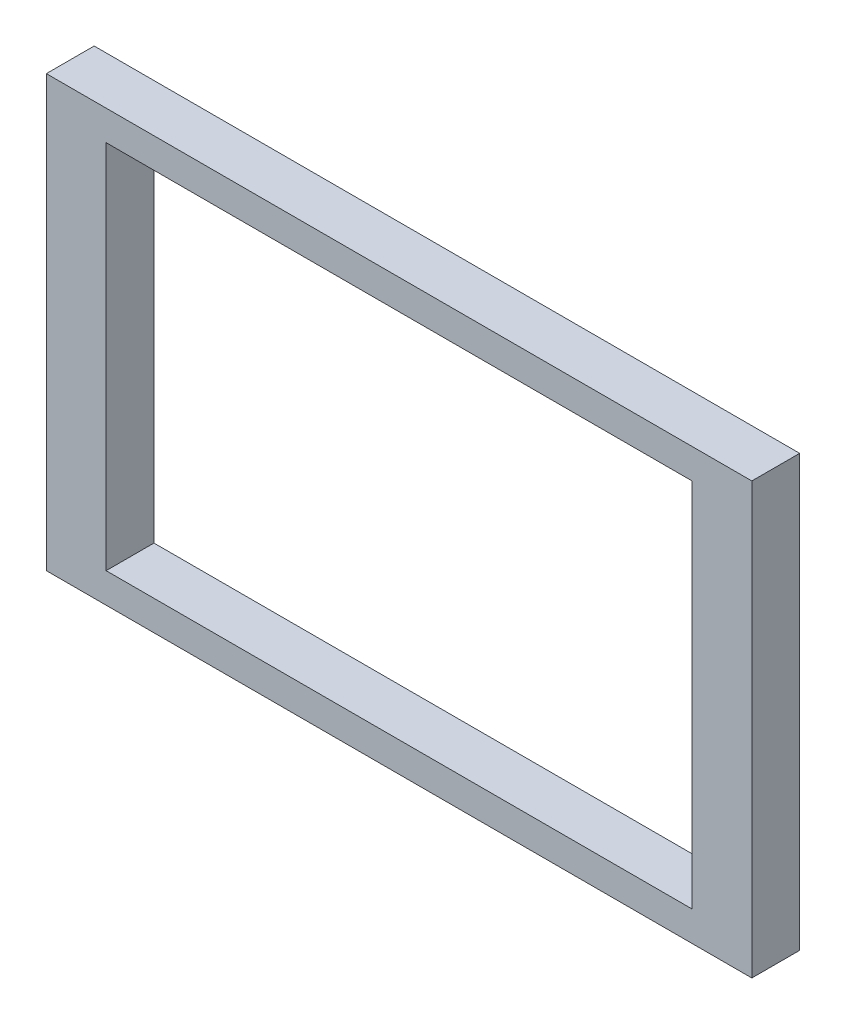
SolidWorks part; units mm, degrees
ref_plane "Plan de face" through (0, 0, 0) normal (0, 0, 1) x (1, 0, 0)
ref_plane "Plan de dessus" through (0, 0, 0) normal (0, 1, 0) x (1, 0, 0)
ref_plane "Plan de droite" through (0, 0, 0) normal (1, 0, 0) x (0, 0, -1)
sketch "Esquisse1" plane through (0, 0, 0) normal (0, 0, 1) x (1, 0, 0)
  line L1 (0, 0) -> (59, 0)
  line L2 (0, 0) -> (0, 36)
  line L3 (0, 36) -> (59, 36)
  line L4 (59, 0) -> (59, 36)
  dimension "D1" = 59
  dimension "D2" = 36
extrude "Extrusion1" add sketch "Esquisse1" along normal blind 4
sketch "Esquisse2" plane through (0, 0, 4) normal (0, 0, 1) x (1, 0, 0)
  line L0 (5, 33.5) -> (54, 33.5)
  line L3 (5, 2.5) -> (54, 2.5)
  line L8 (5, 33.5) -> (5, 2.5)
  line L9 (54, 33.5) -> (54, 2.5)
extrude "Enlèv. mat.-Extru.1" cut sketch "Esquisse2" against normal up to next
